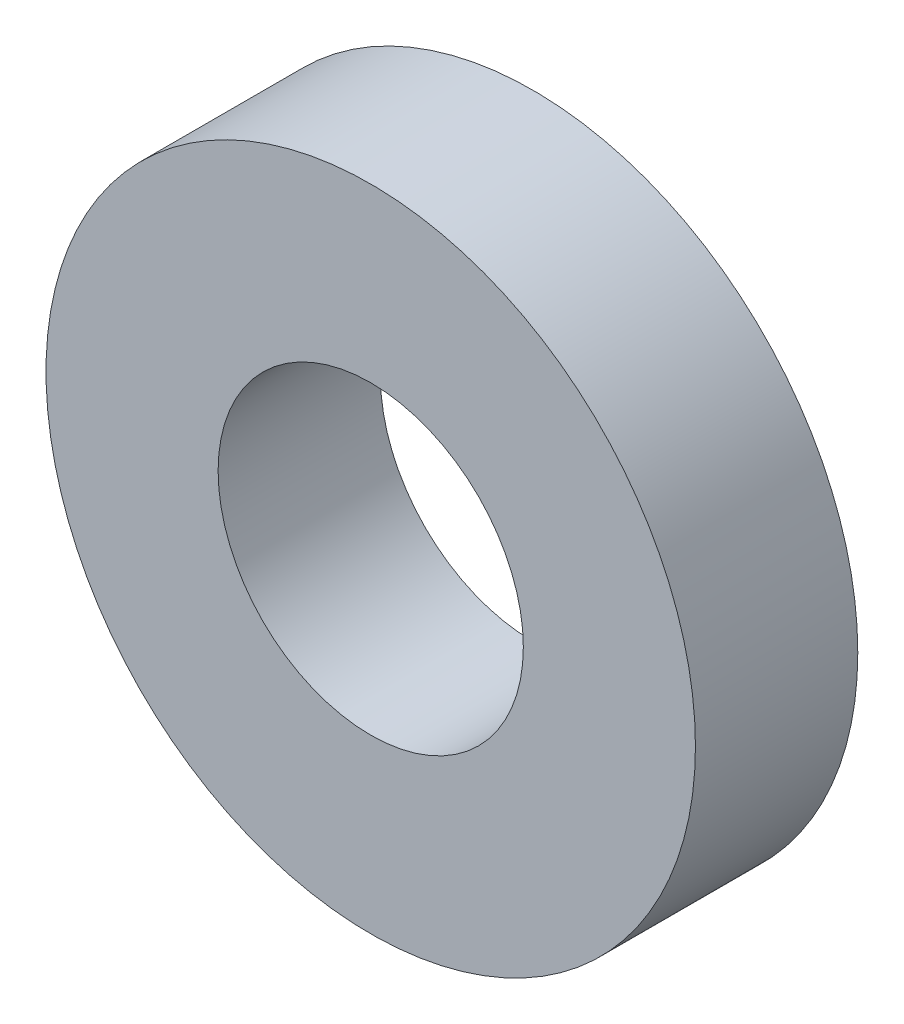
SolidWorks part; units mm, degrees
ref_plane "Front" through (0, 0, 0) normal (0, 0, 1) x (1, 0, 0)
ref_plane "Top" through (0, 0, 0) normal (0, 1, 0) x (1, 0, 0)
ref_plane "Right" through (0, 0, 0) normal (1, 0, 0) x (0, 0, -1)
sketch "Sketch1" plane through (0, 0, 0) normal (0, 0, 1) x (1, 0, 0)
  circle A0 centre (0, 0) radius 2.3876
  circle A1 centre (0, 0) radius 5.08
  dimension "D1" = 4.7752
  dimension "D2" = 10.16
extrude "Extrude1" add sketch "Sketch1" along normal blind 2.54
